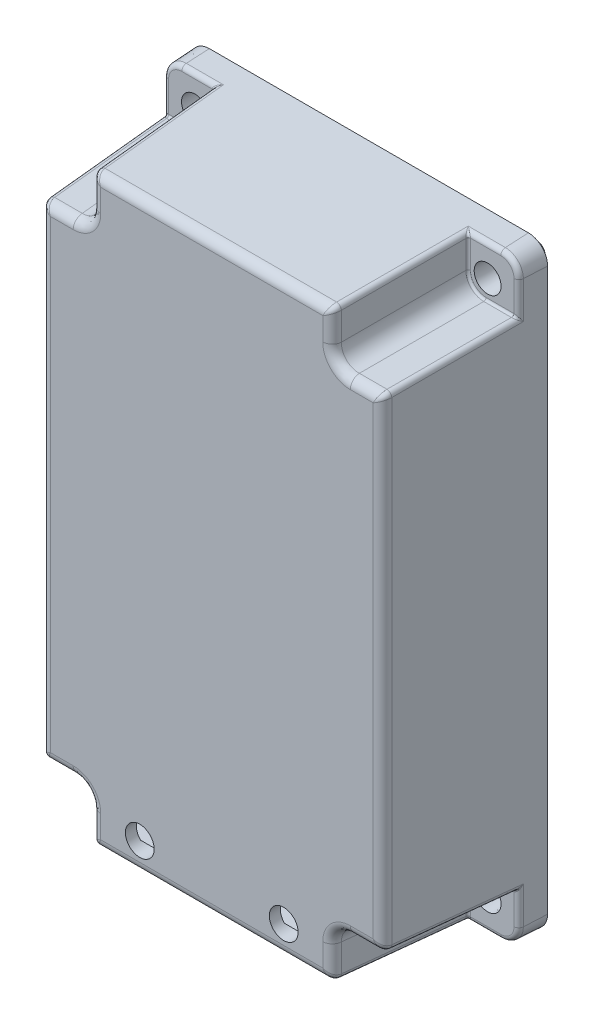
SolidWorks part; units mm, degrees
ref_plane "Plan1" through (0, 0, 0) normal (0, 0, 1) x (1, 0, 0)
ref_plane "Plan2" through (0, 0, 0) normal (0, 1, 0) x (1, 0, 0)
ref_plane "Plan3" through (0, 0, 0) normal (1, 0, 0) x (0, 0, -1)
sketch "Esquisse4" plane through (0, 0, 0) normal (0, 0, 1) x (1, 0, 0)
  line L0 (0, 69.0337) -> (0, -67.0254) construction
  line L1 (45.9388, 0) -> (-47.696, 0) construction
  line L2 (-26.75, 62.5) -> (26.75, 62.5)
  line L3 (37.25, -52) -> (37.25, 52)
  line L4 (26.75, 62.5) -> (26.75, 52)
  line L5 (26.75, 52) -> (37.25, 52)
  line L6 (33.7512, 62.5) -> (-33.7512, 62.5) construction
  line L7 (37.25, -59.0012) -> (37.25, 59.0012) construction
  line L8 (-26.75, 62.5) -> (-26.75, 52)
  line L9 (-26.75, 52) -> (-37.25, 52)
  line L10 (-37.25, -52) -> (-37.25, 52)
  line L11 (-26.75, -52) -> (-37.25, -52)
  line L12 (-26.75, -62.5) -> (-26.75, -52)
  line L13 (-26.75, -62.5) -> (26.75, -62.5)
  line L14 (26.75, -62.5) -> (26.75, -52)
  line L15 (26.75, -52) -> (37.25, -52)
  point P16 (0, 62.5)
  point P20 (-37.25, 0)
  point P25 (37.25, 0)
  dimension "D1" = 10.5
  dimension "D2" = 10.5
extrude "Base-Extrusion" add sketch "Esquisse4" along normal blind 32.75 draft 3
shell "Coque5" thickness 2.3
sketch "Esquisse1" plane through (0, 0, 0) normal (0, 0, 1) x (1, 0, 0)
  line L0 (34.95, -58.7) -> (34.95, 58.7)
  line L1 (-33.45, -60.2) -> (33.45, -60.2)
  line L2 (-34.95, 58.7) -> (-34.95, -58.7)
  line L3 (33.45, 60.2) -> (-33.45, 60.2)
  line L4 (35.55, -59.0012) -> (35.55, 59.0012)
  line L5 (35.55, -59.0012) -> (35.55, 59.0012)
  line L6 (-33.7512, -60.8) -> (33.7512, -60.8)
  line L7 (-33.7512, -60.8) -> (33.7512, -60.8)
  line L8 (-35.55, 59.0012) -> (-35.55, -59.0012)
  line L9 (-35.55, 59.0012) -> (-35.55, -59.0012)
  line L10 (33.7512, 60.8) -> (-33.7512, 60.8)
  line L11 (33.7512, 60.8) -> (-33.7512, 60.8)
  arc A0 (33.45, 60.2) -> (34.95, 58.7) centre (33.45, 58.7) cw
  arc A1 (-34.95, 58.7) -> (-33.45, 60.2) centre (-33.45, 58.7) cw
  arc A2 (34.95, -58.7) -> (33.45, -60.2) centre (33.45, -58.7) cw
  arc A3 (-33.45, -60.2) -> (-34.95, -58.7) centre (-33.45, -58.7) cw
  dimension "D3" = 1.5
  dimension "D4" = 1.5
  dimension "D5" = 0.6
  dimension "D2" = 0.6
  dimension "D6" = 0.6
  dimension "D7" = 0.6
  dimension "D1" = 0
extrude "Boss.-Extru.3" add sketch "Esquisse1" against normal blind 1.25 draft 3
sketch "Esquisse6" plane through (0, 0, 0) normal (0, 0, 1) x (1, 0, 0)
  line L0 (0, 65.7703) -> (0, -69.2847) construction
  line L1 (55.478, 0) -> (-44.9346, 0) construction
  line L2 (-25.0336, 62.5) -> (-33.25, 62.5)
  line L3 (25.0336, 62.5) -> (33.25, 62.5)
  line L4 (37.25, -59.0012) -> (37.25, 59.0012) construction
  line L5 (-37.25, 59.0012) -> (-37.25, -59.0012) construction
  line L6 (37.25, 58.5) -> (37.25, 50.2836)
  line L7 (25.0336, 62.5) -> (25.0336, 50.2836)
  line L8 (25.0336, 50.2836) -> (37.25, 50.2836)
  line L9 (-25.0336, 62.5) -> (-25.0336, 50.2836)
  line L10 (-37.25, 58.5) -> (-37.25, 50.2836)
  line L11 (-25.0336, 50.2836) -> (-37.25, 50.2836)
  line L12 (37.25, -58.5) -> (37.25, -50.2836)
  line L13 (25.0336, -62.5) -> (33.25, -62.5)
  line L14 (25.0336, -62.5) -> (25.0336, -50.2836)
  line L15 (25.0336, -50.2836) -> (37.25, -50.2836)
  line L16 (-25.0336, -50.2836) -> (-37.25, -50.2836)
  line L17 (-37.25, -58.5) -> (-37.25, -50.2836)
  line L18 (-25.0336, -62.5) -> (-33.25, -62.5)
  line L19 (-25.0336, -62.5) -> (-25.0336, -50.2836)
  line L20 (-33.7512, -62.5) -> (33.7512, -62.5) construction
  line L21 (33.7512, 62.5) -> (-33.7512, 62.5) construction
  line L22 (25.0336, 50.2836) -> (25.0336, 60.7836) construction
  line L23 (35.5336, 50.2836) -> (25.0336, 50.2836) construction
  circle A0 centre (-30.5012, 55.7512) radius 2.5
  circle A1 centre (30.5012, -55.7512) radius 2.5
  circle A2 centre (-30.5012, -55.7512) radius 2.5
  arc A3 (37.25, -58.5) -> (33.25, -62.5) centre (33.25, -58.5) cw
  circle A4 centre (30.5012, 55.7512) radius 2.5
  arc A5 (-33.25, -62.5) -> (-37.25, -58.5) centre (-33.25, -58.5) cw
  arc A6 (33.25, 62.5) -> (37.25, 58.5) centre (33.25, 58.5) cw
  arc A7 (-37.25, 58.5) -> (-33.25, 62.5) centre (-33.25, 58.5) cw
  dimension "D1" = 5
  dimension "D2" = 4
extrude "Boss.-Extru.5" add sketch "Esquisse6" along normal blind 5.75 draft 3
fillet "Congé1" radius 3.75
fillet "Congé5" radius 6.05
chamfer "Chanfrein1" distance 1.5 angle 45
fillet "Congé2" radius 2
fillet "Congé3" radius 1
fillet "Congé4" radius 0.5
sketch "Esquisse9" plane through (0, -62.3288, 3.2665) normal (0, -0.9986, 0.0523) x (1, 0, 0)
  line L0 (0, 24.8236) -> (0, -12.5329) construction
  line L2 (-14.25, 23.7167) -> (-14.25, -4.4269) construction
  line L3 (-33.7512, -4.4269) -> (33.7512, -4.4269) construction
  line L4 (-14.25, -4.4269) -> (-6.25, -4.4269)
  line L5 (-14.25, -4.4269) -> (-22.25, -4.4269)
  line L6 (-6.25, -4.4269) -> (-6.759, 5.9409)
  line L8 (-22.25, -4.4269) -> (-21.741, 5.9409)
  arc A0 (-6.759, 5.9409) -> (-21.741, 5.9409) centre (-14.25, 5.5731) ccw
  dimension "D2" = 15
  dimension "D1" = 14.25
  dimension "D3" = 10
  dimension "D4" = 8
extrude "Enlèv. mat.-Extru.2" cut sketch "Esquisse9" against normal up to next
sketch "Esquisse10" plane through (0, 0, 30.45) normal (0, 0, -1) x (-1, 0, 0)
  line L0 (6.3068, -62.5) -> (-33.25, -62.5) construction
  line L2 (0, 0) -> (0, -66.4821) construction
  circle A0 centre (15, -55) radius 3
  circle A1 centre (-15, -55) radius 3
  dimension "D2" = 6
  dimension "D1" = 7.5
  dimension "D3" = 15
extrude "Enlèv. mat.-Extru.3" cut sketch "Esquisse10" against normal mid plane 10
sketch "Esquisse12" plane through (0, 0, 0) normal (0, 0, -1) x (-1, 0, 0)
  line L0 (25.5576, -56.5) -> (21.6983, -58.7281)
  line L1 (31.25, -50.8076) -> (33.4781, -46.9483)
  line L2 (37.25, 58.5) -> (37.25, -58.5) construction
  line L3 (31.25, -50.8076) -> (31.25, -42.4896) construction
  line L4 (33.25, -62.5) -> (22.1932, -62.5) construction
  line L6 (21.6983, -58.7281) -> (21.6983, -46.9483)
  line L7 (21.6983, -46.9483) -> (33.4781, -46.9483)
  line L8 (25.5576, -56.5) -> (16.5604, -56.5) construction
  arc A0 (31.25, -50.8076) -> (25.5576, -56.5) centre (30.5012, -55.7512) ccw
  dimension "D3" = 10
  dimension "D1" = 6
  dimension "D2" = 30
  dimension "D4" = 30
  dimension "D5" = 6
extrude "Enlèv. mat.-Extru.4" cut sketch "Esquisse12" against normal blind 9 draft 3
chamfer "Chanfrein2" distance 1.2 angle 45
